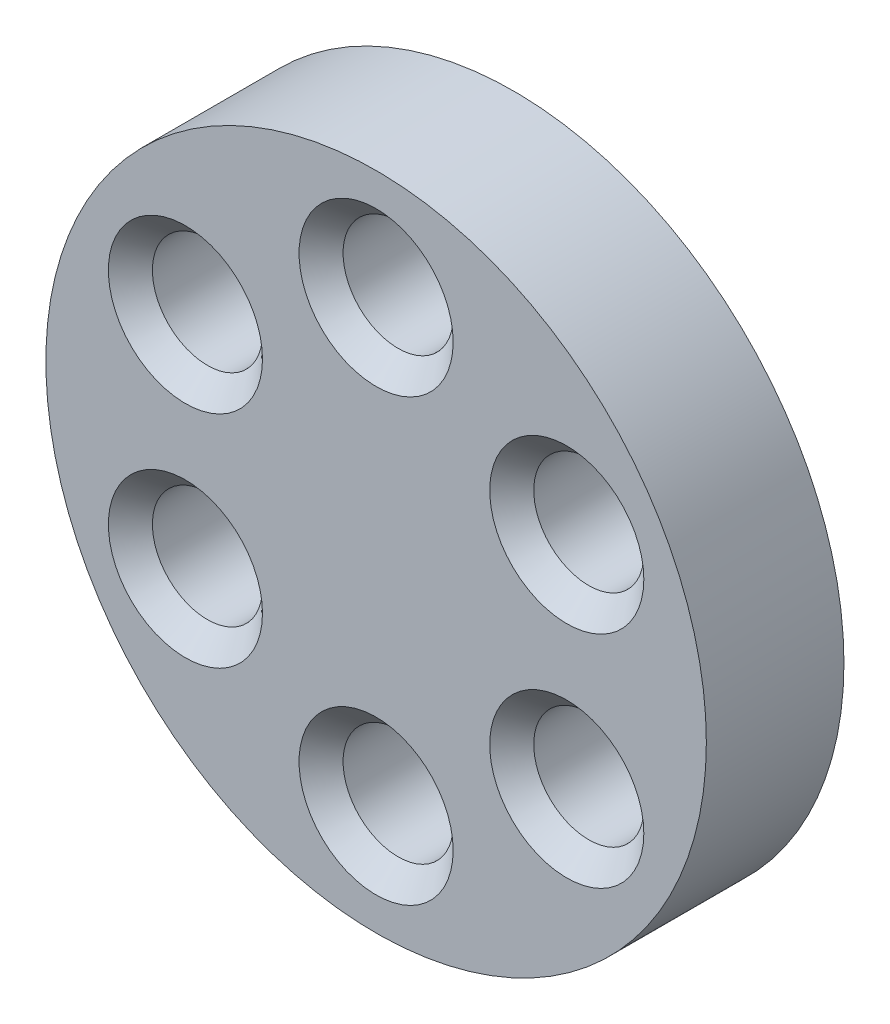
SolidWorks part; units mm, degrees
ref_plane "Płaszczyzna przednia" through (0, 0, 0) normal (0, 0, 1) x (1, 0, 0)
ref_plane "Płaszczyzna górna" through (0, 0, 0) normal (0, 1, 0) x (1, 0, 0)
ref_plane "Płaszczyzna prawa" through (0, 0, 0) normal (1, 0, 0) x (0, 0, -1)
sketch "Szkic1" plane through (0, 0, 0) normal (0, 0, 1) x (1, 0, 0)
  circle A0 centre (0, 0) radius 60
  dimension "D1" = 120
extrude "Dodanie-wyciągnięcie1" add sketch "Szkic1" along normal blind 25
sketch "Szkic2" plane through (0, 0, 25) normal (0, 0, 1) x (1, 0, 0)
  circle A0 centre (0, 0) radius 40 construction
  circle A1 centre (0, 40) radius 10
  dimension "D1" = 80
  dimension "D2" = 20
extrude "Wytnij-wyciągnięcie1" cut sketch "Szkic2" against normal through all
chamfer "Sfazowanie1" distance 4 angle 45 2 edges at (10, 40, 25) (10, 40, 0)
pattern_circular "Szyk kołowy1" count 6 over 360 about axis through (0, 0, 0) along (0, 0, 1) of "Wytnij-wyciągnięcie1", "Sfazowanie1"
